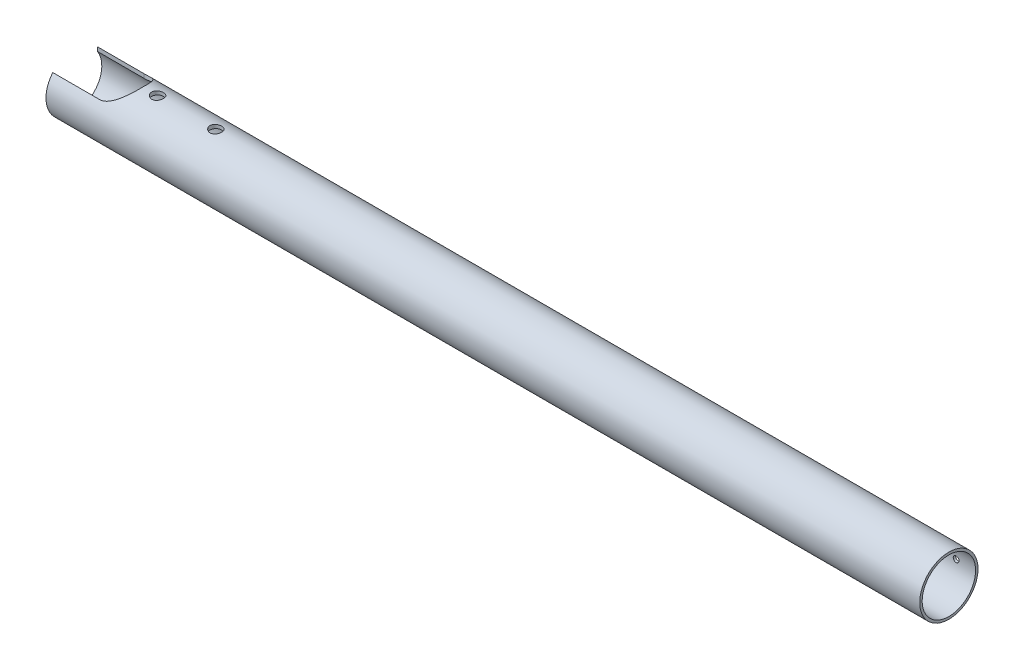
SolidWorks part; units mm, degrees
ref_plane "Plan1" through (0, 0, 0) normal (0, 0, 1) x (1, 0, 0)
ref_plane "Plan2" through (0, 0, 0) normal (0, 1, 0) x (1, 0, 0)
ref_plane "Plan3" through (0, 0, 0) normal (1, 0, 0) x (0, 0, -1)
ref_plane "Plan4" through (0, 26, 0) normal (0, 1, 0) x (-1, 0, 0)
sketch "Esquisse1" plane through (0, 0, 0) normal (1, 0, 0) x (0, 0, -1)
  circle A0 centre (0, 0) radius 30
extrude "Base-Extrusion" add sketch "Esquisse1" along normal blind 900
shell "Coque1" thickness 2.5
sketch "Esquisse2" plane through (0, 0, 0) normal (0, 1, 0) x (1, 0, 0)
  line L1 (-10, 23) -> (48, 23)
  line L2 (-10, 23) -> (-10, -23)
  line L3 (-10, -23) -> (48, -23)
  line L4 (70, 1) -> (70, -1)
  arc A0 (70, 1) -> (48, 23) centre (48, 1) ccw
  arc A1 (48, -23) -> (70, -1) centre (48, -1) ccw
  dimension "D1" = 22
extrude "Enlèv. mat.-Extru.1" cut sketch "Esquisse2" along normal blind 100
sketch "Esquisse4" plane through (0, 26, 0) normal (0, 1, 0) x (-1, 0, 0)
  line L1 (-160, 10) -> (-71, 10)
  line L2 (-160, 10) -> (-160, -10)
  line L3 (-160, -10) -> (-71, -10)
  line L4 (-71, 10) -> (-71, -10)
extrude "Boss.-Extru.1" add sketch "Esquisse4" along normal blind 2
sketch "Esquisse3" plane through (0, 0, 0) normal (0, 1, 0) x (1, 0, 0)
  circle A0 centre (85, 0) radius 6
  circle A1 centre (145, 0) radius 6
extrude "Enlèv. mat.-Extru.2" cut sketch "Esquisse3" along normal blind 100
sketch "Esquisse6" plane through (0, 0, 0) normal (0, 0, 1) x (1, 0, 0)
  line L0 (900, 0) -> (0, 0) construction
  circle A0 centre (880, 0) radius 3
extrude "Enlèv. mat.-Extru.3" cut sketch "Esquisse6" against normal blind 50
